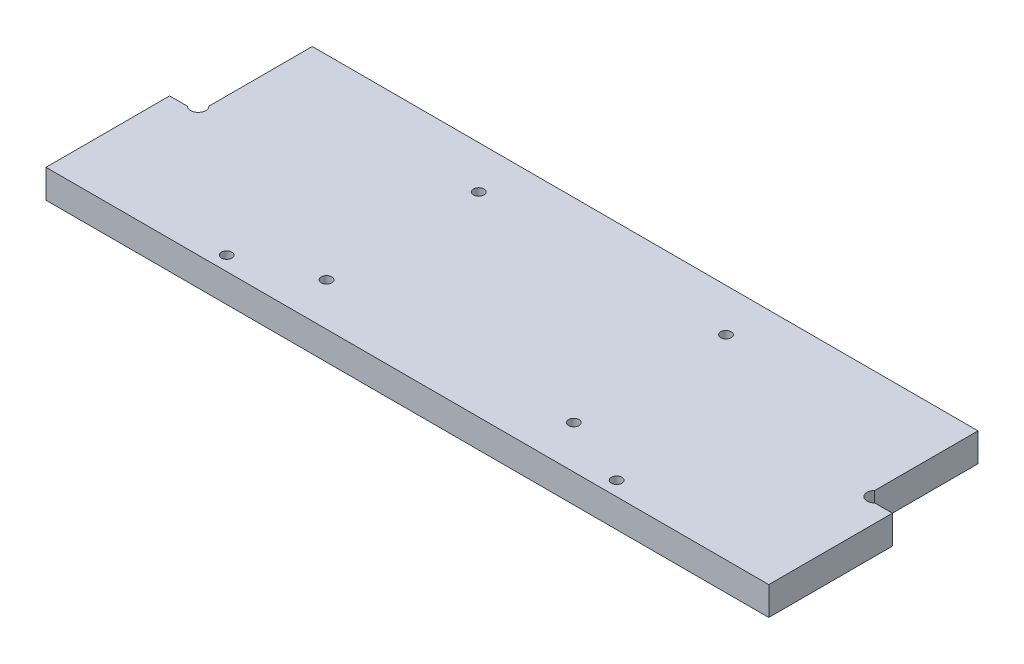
SolidWorks part; units mm, degrees
ref_plane "Plan de face" through (0, 0, 0) normal (0, 0, 1) x (1, 0, 0)
ref_plane "Plan de dessus" through (0, 0, 0) normal (0, 1, 0) x (1, 0, 0)
ref_plane "Plan de droite" through (0, 0, 0) normal (1, 0, 0) x (0, 0, -1)
sketch "Esquisse1" plane through (0, 0, 0) normal (0, 1, 0) x (1, 0, 0)
  line L0 (0, -7.8435) -> (0, 78.3277) construction
  line L1 (-8.7503, 0) -> (184.4278, 0) construction
  line L2 (152, -12.5292) -> (152, 79.7639) construction
  line L3 (184.4278, 50) -> (-8.7503, 50) construction
  line L4 (76, 70.8498) -> (76, -2.2669) construction
  line L5 (171.996, 26) -> (141.3421, 26) construction
  line L6 (132.3963, 3) -> (111.2063, 3) construction
  line L7 (117, -12.5292) -> (117, 11.2607) construction
  line L8 (146, 59.704) -> (146, -2.2669) construction
  line L9 (146, 26) -> (159.3638, 39.3638) construction
  line L10 (146, 28.2627) -> (146, 50)
  line L11 (148.2627, 26) -> (152, 26)
  line L12 (152, 26) -> (152, 0)
  line L13 (0, 26) -> (0, 0)
  line L14 (3.7373, 26) -> (0, 26)
  line L15 (6, 28.2627) -> (6, 50)
  line L16 (0, 0) -> (152, 0)
  line L17 (6, 50) -> (146, 50)
  line L18 (91.3689, 25) -> (65.6748, 25) construction
  line L19 (46, 45) -> (106, 45) construction
  line L20 (46, 45) -> (46, 5) construction
  line L21 (46, 5) -> (106, 5) construction
  line L22 (106, 45) -> (106, 5) construction
  line L23 (46, 45) -> (106, 5) construction
  line L24 (46, 5) -> (106, 45) construction
  circle A0 centre (117, 3) radius 1.1
  arc A1 (146, 28.2627) -> (148.2627, 26) centre (147.1314, 27.1314) ccw
  arc A2 (6, 28.2627) -> (3.7373, 26) centre (4.8686, 27.1314) cw
  circle A3 centre (35, 3) radius 1.1
  circle A4 centre (50, 9) radius 1.1
  circle A5 centre (102, 9) radius 1.1
  circle A6 centre (102, 41) radius 1.1
  circle A7 centre (50, 41) radius 1.1
  point P37 (76, 25)
  dimension "D9" = 5
  dimension "D10" = 4
  dimension "D1" = 152
  dimension "D2" = 50
  dimension "D3" = 6
  dimension "D4" = 26
  dimension "D5" = 45
  dimension "D6" = 76
  dimension "D7" = 35
  dimension "D8" = 3
  dimension "D11" = 4
extrude "Boss.-Extru.1" add sketch "Esquisse1" along normal blind 6
